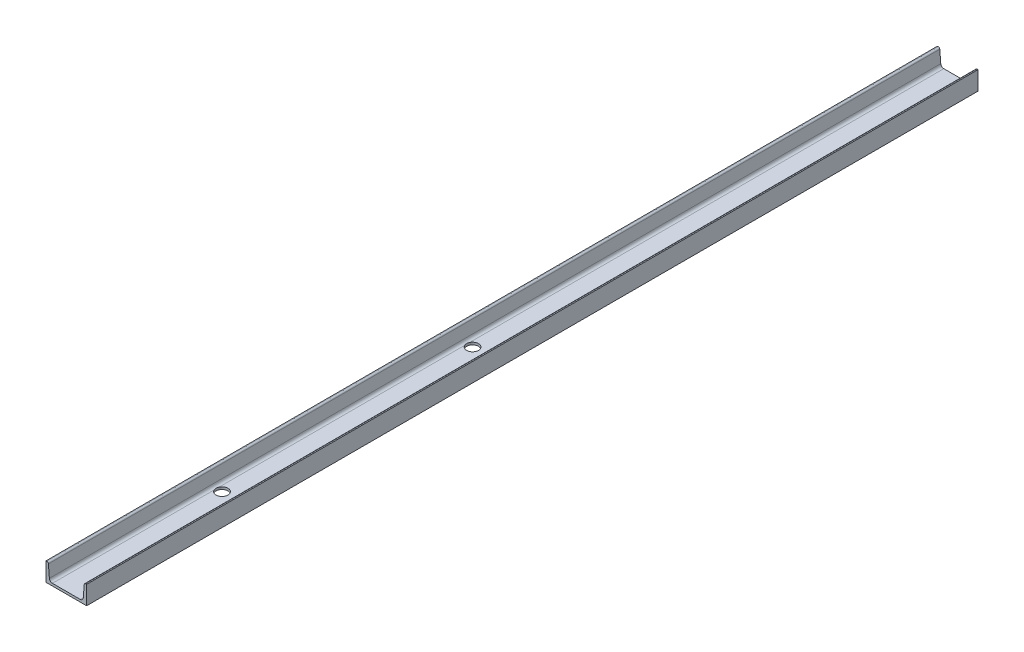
SolidWorks part; units mm, degrees
ref_plane "Plan de face" through (0, 0, 0) normal (0, 0, 1) x (1, 0, 0)
ref_plane "Plan de dessus" through (0, 0, 0) normal (0, 1, 0) x (1, 0, 0)
ref_plane "Plan de droite" through (0, 0, 0) normal (1, 0, 0) x (0, 0, -1)
ref_plane "Plan1" through (0, 0, 1316.5) normal (0, 0, 1) x (1, 0, 0)
sketch "Esquisse1" plane through (0, 0, 1316.5) normal (0, 0, 1) x (1, 0, 0)
  line L0 (41.0512, 7) -> (-41.0512, 7)
  line L1 (-50.0226, 15.2823) -> (-52.8687, 50.8589)
  line L2 (-57.3544, 55) -> (-60, 55)
  line L3 (-60, 55) -> (-60, 0)
  line L4 (-60, 0) -> (60, 0)
  line L5 (60, 0) -> (60, 55)
  line L6 (60, 55) -> (57.3544, 55)
  line L7 (52.8687, 50.8589) -> (50.0226, 15.2823)
  arc A0 (50.0226, 15.2823) -> (41.0512, 7) centre (41.0512, 16) cw
  arc A1 (-41.0512, 7) -> (-50.0226, 15.2823) centre (-41.0512, 16) cw
  arc A2 (-52.8687, 50.8589) -> (-57.3544, 55) centre (-57.3544, 50.5) ccw
  arc A3 (57.3544, 55) -> (52.8687, 50.8589) centre (57.3544, 50.5) ccw
extrude "Boss.-Extru.1" add sketch "Esquisse1" against normal blind 2633
sketch "Esquisse2" plane through (0, 7, 0) normal (0, 1, 0) x (1, 0, 0)
  line L0 (60, -681.5) -> (-60, -681.5) construction
  line L1 (60, 58.5) -> (-60, 58.5) construction
  line L2 (-60, 1316.5) -> (-60, -1316.5) construction
  circle A0 centre (-25, -831.5) radius 17.5
  circle A1 centre (-25, -91.5) radius 17.5
  dimension "D4" = 35
  dimension "D1" = 150
  dimension "D2" = 150
  dimension "D3" = 35
extrude "Enlèv. mat.-Extru.1" cut sketch "Esquisse2" against normal through all and the other way through all
